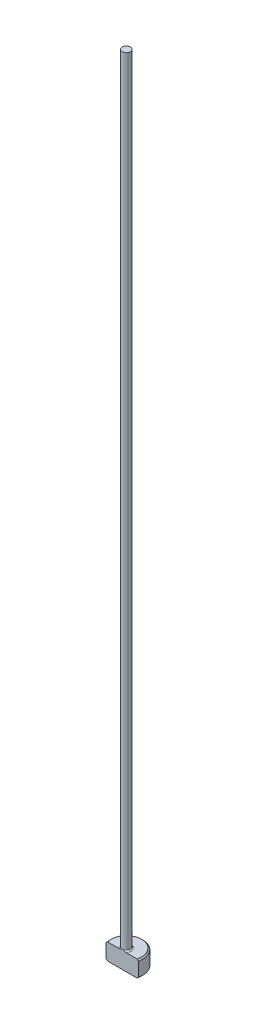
SolidWorks part; units mm, degrees
ref_plane "Front Plane" through (0, 0, 0) normal (0, 0, 1) x (1, 0, 0)
ref_plane "Top Plane" through (0, 0, 0) normal (0, 1, 0) x (1, 0, 0)
ref_plane "Right Plane" through (0, 0, 0) normal (1, 0, 0) x (0, 0, -1)
sketch "Sketch1" plane through (0, 0, 0) normal (0, 0, 1) x (1, 0, 0)
  line L0 (0, 259.9588) -> (0, -15.1925) construction
  line L1 (0, 0) -> (-3.175, 0)
  line L2 (-3.175, 0) -> (-3.175, 3.175)
  line L3 (-3.175, 3.175) -> (-0.7937, 3.175)
  line L4 (-0.7937, 3.175) -> (-0.7937, 152.4)
  line L5 (-0.7937, 152.4) -> (0, 152.4)
  line L6 (0, 152.4) -> (0, 0)
  dimension "L" = 152.4
  dimension "H" = 6.35
  dimension "T" = 3.175
  dimension "D" = 1.5875
revolve "Revolve1" add sketch "Sketch1" angle 360 about L0
chamfer "Chamfer1" distance 0.254 angle 45 2 edges at (0, 3.175, 3.175) (0, 0, 3.175)
fillet "Fillet1" radius 0.254 1 edges at (0, 3.175, 0.7937)
sketch "Sketch2" plane through (0, 0, 0) normal (0, 1, 0) x (1, 0, 0)
  line L0 (-3.0742, -0.7937) -> (3.0742, -0.7937)
  circle A0 centre (0, 0) radius 3.175 construction
  arc A1 (-3.0742, -0.7937) -> (3.0742, -0.7937) centre (0, 0) ccw
  circle A3 centre (0, 0) radius 0.7937 construction
  dimension "D1" = 0
extrude "Key" cut sketch "Sketch2" along normal through all
sketch "Pocket Sketch" plane through (0, 0, 0) normal (0, 0, 1) x (1, 0, 0)
  line L0 (-3.5719, 0) -> (-3.5719, 3.2004)
  line L1 (-3.5719, 3.2004) -> (-1.7542, 3.2004)
  line L2 (-0.9922, 3.9624) -> (-0.9922, 22.225)
  line L3 (-0.9922, 22.225) -> (0, 22.225)
  line L4 (0, 22.225) -> (0, 0)
  line L5 (0, 0) -> (-3.5719, 0)
  line L6 (0, 12.6104) -> (0, -2.4989) construction
  line L7 (-3.175, 2.921) -> (-3.175, 0.254) construction
  line L8 (2.921, 3.175) -> (-2.921, 3.175) construction
  line L9 (-0.7937, 152.4) -> (-0.7937, 3.429) construction
  line L10 (-1.7542, 3.2004) -> (-0.9922, 3.9624)
  point P3 (-0.9922, 3.2004)
  dimension "D1" = 7.1437
  dimension "D2" = 0.3969
  dimension "D3" = 0.0254
  dimension "D4" = 0.1984
  dimension "D5" = 1.9844
  dimension "D6" = 22.225
